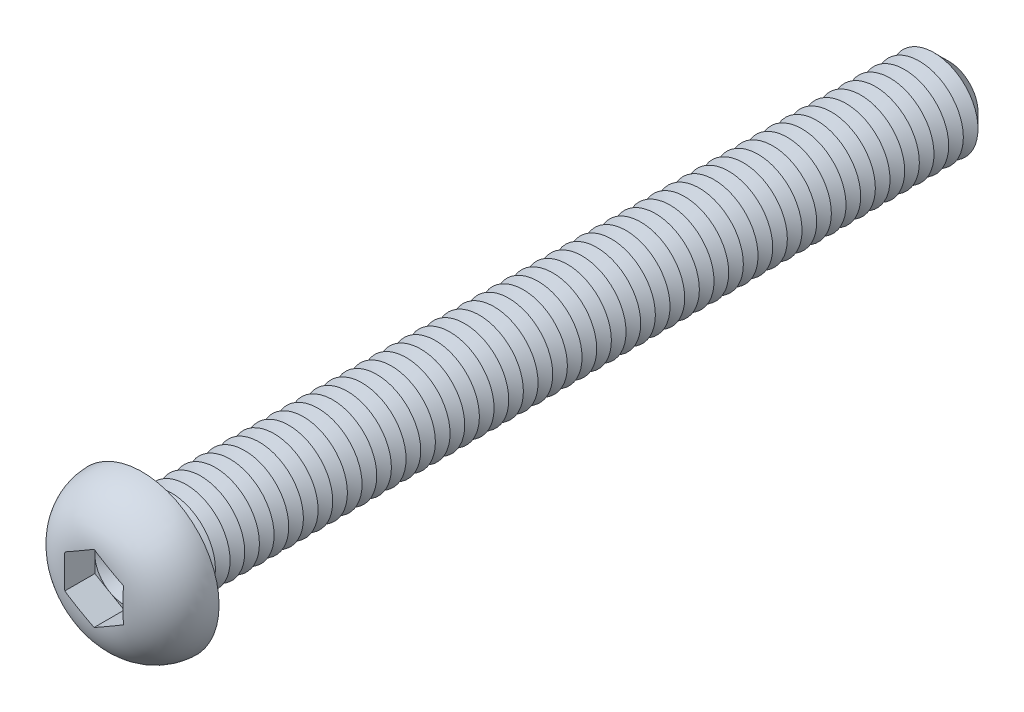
SolidWorks part; units mm, degrees
ref_plane "Front Plane" through (0, 0, 0) normal (0, 0, 1) x (1, 0, 0)
ref_plane "Top Plane" through (0, 0, 0) normal (0, 1, 0) x (1, 0, 0)
ref_plane "Right Plane" through (0, 0, 0) normal (1, 0, 0) x (0, 0, -1)
sketch "Sketch1" plane through (0, 0, 0) normal (1, 0, 0) x (0, 0, -1)
  line L0 (-47.9342, 0) -> (60.3146, 0) construction
sketch "Sketch2" plane through (0, 0, 0) normal (1, 0, 0) x (0, 0, -1)
  line L0 (0, 0) -> (-3.3, 0)
  line L1 (-47.9342, 0) -> (60.3146, 0) construction
  line L2 (-3.3, 0) -> (-3.3, 1.8515)
  line L3 (0, 5.25) -> (0, 0)
  arc A0 (-3.3, 1.8515) -> (0, 5.25) centre (0.1, 1.8515) cw
  dimension "D1" = 3.4
  dimension "D2" = 3.3
  dimension "D3" = 5.25
revolve "Revolve1" add sketch "Sketch2" angle 360 about L0
sketch "Sketch3" plane through (0, 0, 3.3) normal (0, 0, 1) x (1, 0, 0)
  line L1 (0, 2.3094) -> (-2, 1.1547)
  line L2 (-2, 1.1547) -> (-2, -1.1547)
  line L3 (-2, -1.1547) -> (0, -2.3094)
  line L4 (0, -2.3094) -> (2, -1.1547)
  line L5 (2, -1.1547) -> (2, 1.1547)
  line L6 (2, 1.1547) -> (0, 2.3094)
  circle A0 centre (0, 0) radius 2 construction
  dimension "D1" = 4
extrude "Cut-Extrude1" cut sketch "Sketch3" against normal blind 2.08
sketch "Sketch4" plane through (0, 0, 0) normal (0, 0, -1) x (-1, 0, 0)
  circle A0 centre (0, 0) radius 3
  dimension "D1" = 6
extrude "Boss-Extrude1" add sketch "Sketch4" along normal blind 55
chamfer "Chamfer1" distance 1 angle 45 1 edges at (-3, 0, -55)
sketch "Sketch5" plane through (0, 0, 0) normal (1, 0, 0) x (0, 0, -1)
  line L0 (1, 3) -> (2, 3)
  line L1 (54, 3) -> (0, 3) construction
  line L2 (2, 3) -> (1.5, 2.134)
  line L3 (1.5, 2.134) -> (1, 3)
  line L4 (0, -5.25) -> (0, 5.25) construction
  line L5 (54, 3) -> (0, 3) construction
  dimension "D1" = 1
  dimension "D2" = 1
revolve "Cut-Revolve1" cut sketch "Sketch5" angle 360 about L0
pattern_linear "LPattern1" count 53 spacing 1 along (0, 0, -1) of "Cut-Revolve1"
fillet "Fillet2" radius 0.5 1 edges at (-3, 0, 0)
sketch "Sketch6" plane through (0, 0, 1.22) normal (0, 0, 1) x (1, 0, 0)
  line L0 (0, -2.3094) -> (2, -1.1547) construction
  circle A0 centre (0, 0) radius 2
extrude "Cut-Extrude2" cut sketch "Sketch6" against normal through all draft 60
